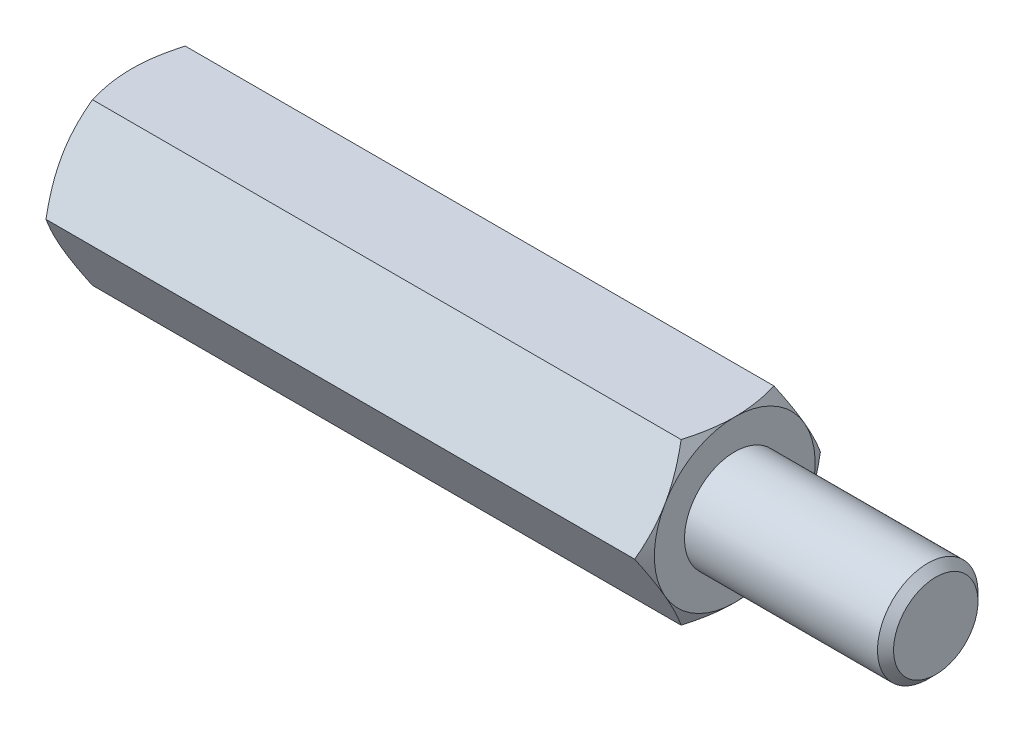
SolidWorks part; units mm, degrees
ref_plane "Front Plane" through (0, 0, 0) normal (0, 0, 1) x (1, 0, 0)
ref_plane "Top Plane" through (0, 0, 0) normal (0, 1, 0) x (1, 0, 0)
ref_plane "Right Plane" through (0, 0, 0) normal (1, 0, 0) x (0, 0, -1)
sketch "Sketch1" plane through (0, 0, 0) normal (1, 0, 0) x (0, 0, -1)
  line L1 (2.3094, 4) -> (-2.3094, 4)
  line L2 (-2.3094, 4) -> (-4.6188, 0)
  line L3 (-4.6188, 0) -> (-2.3094, -4)
  line L4 (-2.3094, -4) -> (2.3094, -4)
  line L5 (2.3094, -4) -> (4.6188, 0)
  line L6 (4.6188, 0) -> (2.3094, 4)
  circle A0 centre (0, 0) radius 4 construction
  dimension "D1" = 8
extrude "Extrude2" add sketch "Sketch1" along normal mid plane 30
sketch "Sketch2" plane through (0, 0, 0) normal (0, 0, 1) x (1, 0, 0)
  line L0 (-15, 4) -> (-13.5, 6.5981)
  line L1 (-15, 7) -> (-15, 4)
  line L3 (0, 0) -> (50000, 0) construction
  arc A0 (-13.5, 6.5981) -> (-15, 7) centre (-14.1962, 7) ccw
  dimension "D1" = 30
  dimension "D2" = 3
revolve "Cut-Revolve1" cut sketch "Sketch2" angle 360 about L3
mirror "Mirror1" about plane through (0, 0, 0) normal (1, 0, 0) of "Cut-Revolve1"
sketch "Sketch3" plane through (-15, 0, 0) normal (-1, 0, 0) x (0, 0, 1)
  circle A0 centre (0, 0) radius 2.1
  dimension "D1" = 4.2
extrude "Extrude3" cut sketch "Sketch3" against normal blind 10
sketch "Sketch4" plane through (0, 0, 0) normal (0, 0, 1) x (1, 0, 0)
  line L0 (-5, 0) -> (-5, 2.1)
  line L1 (14.6427, 0) -> (-14.6427, 0) construction
  line L2 (-5, 2.1) -> (-3.7876, 0)
  line L3 (-3.7876, 0) -> (-5, 0)
  line L4 (-15, 2) -> (-15, -2) construction
  point P4 (-15, 0)
  dimension "D1" = 30
  dimension "D2" = 2.1
  dimension "D3" = 10
revolve "Cut-Revolve2" cut sketch "Sketch4" angle 360 about L3
sketch "Sketch5" plane through (15, 0, 0) normal (1, 0, 0) x (0, 0, -1)
  circle A0 centre (0, 0) radius 2.5
  dimension "D1" = 5
extrude "Extrude4" add sketch "Sketch5" along normal blind 10
chamfer "Chamfer1" distance 0.4 angle 45 1 edges at (25, 0, -2.5)
equation "\"D2@Sketch4\" = \"D1@Sketch3\"/2"
